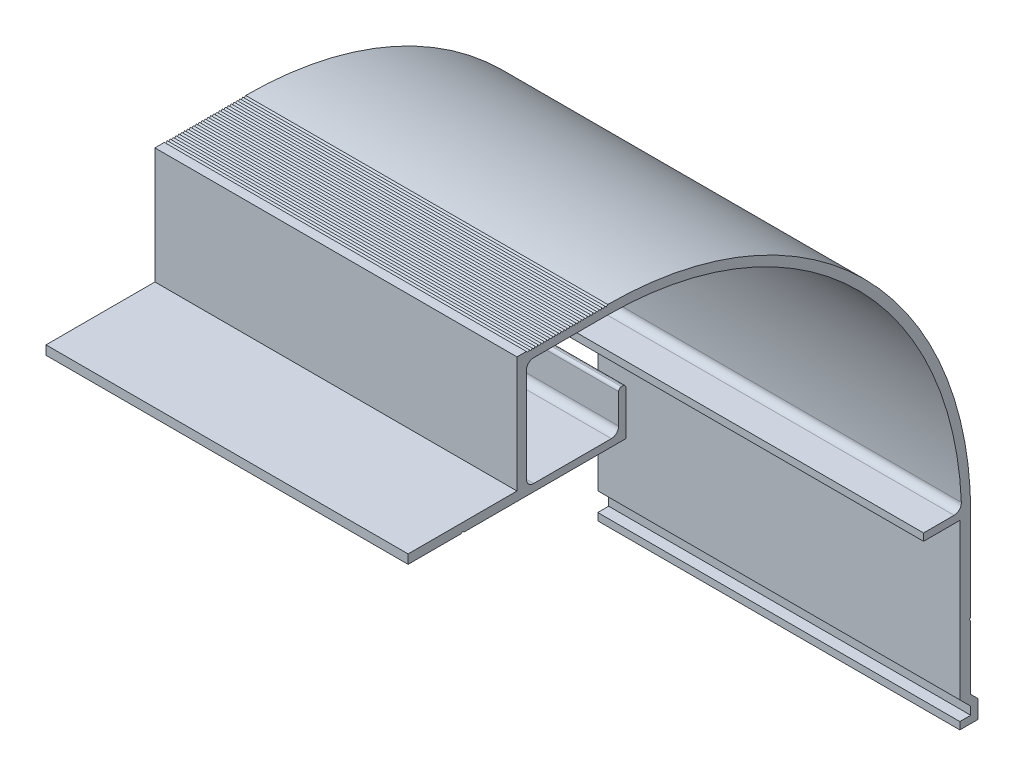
SolidWorks part; units mm, degrees
ref_plane "Front Plane" through (0, 0, 0) normal (0, 0, 1) x (1, 0, 0)
ref_plane "Top Plane" through (0, 0, 0) normal (0, 1, 0) x (1, 0, 0)
ref_plane "Right Plane" through (0, 0, 0) normal (1, 0, 0) x (0, 0, -1)
sketch "Sketch1" plane through (0, 0, 0) normal (1, 0, 0) x (0, 0, -1)
  line L0 (55.1396, 32.0812) -> (34.6878, 32.0812)
  line L1 (54.7386, 34.1865) -> (55.1396, 34.5876)
  line L2 (54.3376, 34.5876) -> (54.7386, 34.1865)
  line L3 (53.9365, 34.1865) -> (54.3376, 34.5876)
  line L4 (53.5355, 34.5876) -> (53.9365, 34.1865)
  line L5 (53.1345, 34.1865) -> (53.5355, 34.5876)
  line L6 (52.7335, 34.5876) -> (53.1345, 34.1865)
  line L7 (52.3325, 34.1865) -> (52.7335, 34.5876)
  line L8 (51.9315, 34.5876) -> (52.3325, 34.1865)
  line L9 (51.5305, 34.1865) -> (51.9315, 34.5876)
  line L10 (51.1294, 34.5876) -> (51.5305, 34.1865)
  line L11 (50.7284, 34.1865) -> (51.1294, 34.5876)
  line L12 (50.3274, 34.5876) -> (50.7284, 34.1865)
  line L13 (49.9264, 34.1865) -> (50.3274, 34.5876)
  line L14 (49.5254, 34.5876) -> (49.9264, 34.1865)
  line L15 (49.1244, 34.1865) -> (49.5254, 34.5876)
  line L16 (48.7233, 34.5876) -> (49.1244, 34.1865)
  line L17 (48.3223, 34.1865) -> (48.7233, 34.5876)
  line L18 (47.9213, 34.5876) -> (48.3223, 34.1865)
  line L19 (47.5203, 34.1865) -> (47.9213, 34.5876)
  line L20 (47.1193, 34.5876) -> (47.5203, 34.1865)
  line L21 (46.7183, 34.1865) -> (47.1193, 34.5876)
  line L22 (46.3173, 34.5876) -> (46.7183, 34.1865)
  line L23 (45.9162, 34.1865) -> (46.3173, 34.5876)
  line L24 (45.5152, 34.5876) -> (45.9162, 34.1865)
  line L25 (45.1142, 34.1865) -> (45.5152, 34.5876)
  line L26 (44.7132, 34.5876) -> (45.1142, 34.1865)
  line L27 (44.3122, 34.1865) -> (44.7132, 34.5876)
  line L28 (43.9112, 34.5876) -> (44.3122, 34.1865)
  line L29 (43.5101, 34.1865) -> (43.9112, 34.5876)
  line L30 (43.1091, 34.5876) -> (43.5101, 34.1865)
  line L31 (42.7081, 34.1865) -> (43.1091, 34.5876)
  line L32 (42.3071, 34.5876) -> (42.7081, 34.1865)
  line L33 (41.9061, 34.1865) -> (42.3071, 34.5876)
  line L34 (41.5051, 34.5876) -> (41.9061, 34.1865)
  line L35 (41.1041, 34.1865) -> (41.5051, 34.5876)
  line L36 (40.703, 34.5876) -> (41.1041, 34.1865)
  line L37 (40.302, 34.1865) -> (40.703, 34.5876)
  line L38 (39.901, 34.5876) -> (40.302, 34.1865)
  line L39 (39.5, 34.1865) -> (39.901, 34.5876)
  line L40 (39.099, 34.5876) -> (39.5, 34.1865)
  line L41 (38.698, 34.1865) -> (39.099, 34.5876)
  line L42 (38.297, 34.5876) -> (38.698, 34.1865)
  line L43 (37.8959, 34.1865) -> (38.297, 34.5876)
  line L44 (37.4949, 34.5876) -> (37.8959, 34.1865)
  line L45 (37.0939, 34.1865) -> (37.4949, 34.5876)
  line L46 (36.6929, 34.5876) -> (37.0939, 34.1865)
  line L47 (36.2919, 34.1865) -> (36.6929, 34.5876)
  line L48 (35.8909, 34.5876) -> (36.2919, 34.1865)
  line L49 (35.4898, 34.1865) -> (35.8909, 34.5876)
  line L50 (35.0888, 34.5876) -> (35.4898, 34.1865)
  line L51 (34.6878, 34.1865) -> (35.0888, 34.5876)
  line L52 (34.2868, 34.5876) -> (34.6878, 34.1865)
  line L53 (33.8858, 34.1865) -> (34.2868, 34.5876)
  line L54 (33.4848, 34.5876) -> (33.8858, 34.1865)
  line L55 (33.0838, 34.1865) -> (33.4848, 34.5876)
  line L56 (32.6827, 34.5876) -> (33.0838, 34.1865)
  line L57 (15.0381, 0.401) -> (15.4391, 0)
  line L58 (14.6371, 0) -> (0, 0)
  line L59 (14.6371, 0) -> (15.0381, 0.401)
  line L60 (154.9924, -90.7297) -> (155.3934, -90.3287)
  line L61 (155.3934, -91.1307) -> (155.3934, -108.7754)
  line L62 (155.3934, -91.1307) -> (154.9924, -90.7297)
  line L63 (152.3858, -113.7881) -> (152.3858, -115.7931)
  line L64 (155.3934, -113.7881) -> (152.3858, -113.7881)
  line L65 (155.3934, -111.611) -> (155.3934, -113.7881)
  line L66 (152.3858, -108.6034) -> (155.3934, -111.611)
  line L67 (152.3858, -65.6662) -> (152.3858, -108.6034)
  line L68 (142.3604, -65.6662) -> (152.3858, -65.6662)
  line L69 (142.3604, -63.6612) -> (142.3604, -65.6662)
  line L70 (150.7979, -63.6612) -> (142.3604, -63.6612)
  line L71 (157.3985, -115.7931) -> (152.3858, -115.7931)
  line L72 (157.3985, -110.7804) -> (157.3985, -115.7931)
  line L73 (155.3934, -108.7754) -> (157.3985, -110.7804)
  line L74 (155.3934, -65.6662) -> (155.3934, -90.3287)
  line L75 (56.1421, 2.0051) -> (34.6878, 2.0051)
  line L76 (58.1472, 12.231) -> (58.1472, 4.0102)
  line L77 (59.3502, 13.033) -> (58.9492, 13.033)
  line L78 (60.1523, 0) -> (60.1523, 12.231)
  line L79 (32.6827, 4.0102) -> (32.6827, 30.0761)
  line L80 (30.0761, 34.5876) -> (32.6827, 34.5876)
  line L81 (30.0761, 2.5063) -> (30.0761, 34.5876)
  line L82 (0, 2.5063) -> (30.0761, 2.5063)
  line L83 (0, 0) -> (0, 2.5063)
  line L84 (60.1523, 0) -> (15.4391, 0)
  arc A0 (152.8013, -61.5721) -> (55.1396, 32.0812) centre (55.1396, -65.6662) ccw
  arc A1 (155.3934, -65.6662) -> (55.1396, 34.5876) centre (55.1396, -65.6662) ccw
  arc A2 (34.6878, 32.0812) -> (32.6827, 30.0761) centre (34.6878, 30.0761) ccw
  arc A3 (150.7979, -63.6612) -> (152.8013, -61.5721) centre (150.7979, -61.6561) ccw
  arc A4 (60.1523, 12.231) -> (59.3502, 13.033) centre (59.3502, 12.231) ccw
  arc A5 (58.9492, 13.033) -> (58.1472, 12.231) centre (58.9492, 12.231) ccw
  arc A6 (56.1421, 2.0051) -> (58.1472, 4.0102) centre (56.1421, 4.0102) ccw
  arc A7 (32.6827, 4.0102) -> (34.6878, 2.0051) centre (34.6878, 4.0102) ccw
extrude "Extrude1" add sketch "Sketch1" along normal mid plane 100
